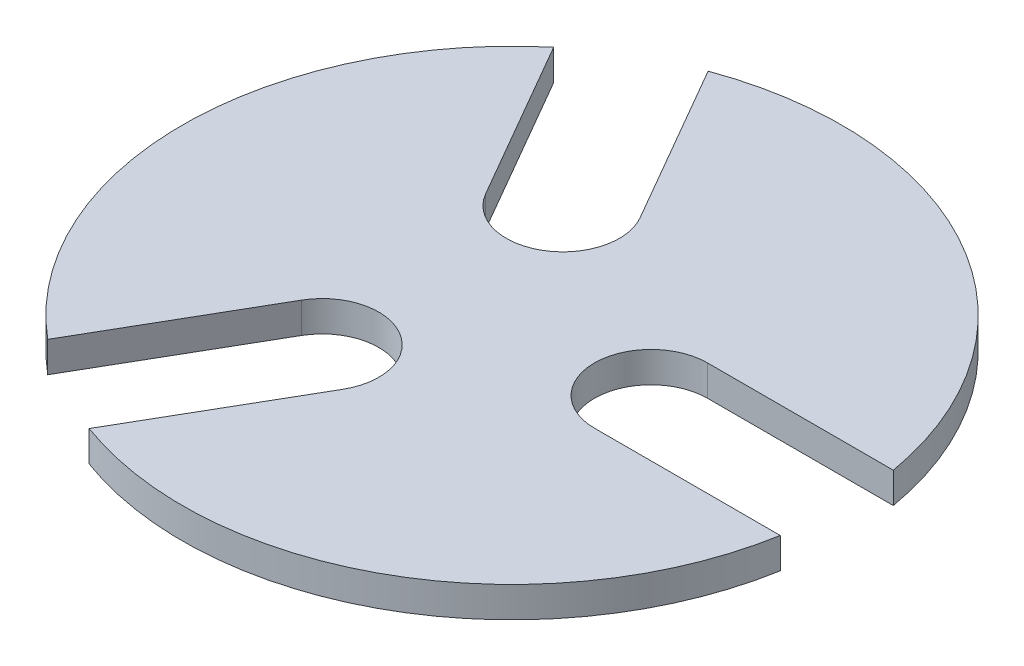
SolidWorks part; units mm, degrees
ref_plane "Front/Back" through (0, 0, 0) normal (0, 0, 1) x (1, 0, 0)
ref_plane "Top/Bottom" through (0, 0, 0) normal (0, 1, 0) x (1, 0, 0)
ref_plane "Right/Left" through (0, 0, 0) normal (1, 0, 0) x (0, 0, -1)
sketch "Sketch1" plane through (0, 0, 0) normal (0, 1, 0) x (1, 0, 0)
  circle A0 centre (0, 0) radius 25.4
  dimension "D1" = 50.8
extrude "Extrude1" add sketch "Sketch1" along normal mid plane 2.3622
sketch "Sketch2" plane through (0, 1.1811, 0) normal (0, 1, 0) x (-1, 0, 0)
  line L0 (0, 0) -> (-26.8274, 0) construction
  line L1 (0, 0) -> (0, 31.6163) construction
  line L2 (-25.0237, -4.3561) -> (-10.7061, -4.3561)
  line L4 (-25.0237, 4.3561) -> (-10.7061, 4.3561)
  arc A0 (-10.7061, -4.3561) -> (-10.7061, 4.3561) centre (-10.7061, 0) ccw
  circle A1 centre (0, 0) radius 25.4
  arc A2 (-25.0237, 4.3561) -> (-25.0237, -4.3561) centre (0, 0) ccw
  dimension "D4" = 8.7122
  dimension "D1" = 10.7061
  dimension "D2" = 0
extrude "Cut-Extrude1" cut sketch "Sketch2" against normal through all
pattern_circular "CirPattern4" count 3 over 360 about axis through (0, 1.1811, 0) along (0, -1, 0) of "Cut-Extrude1"
